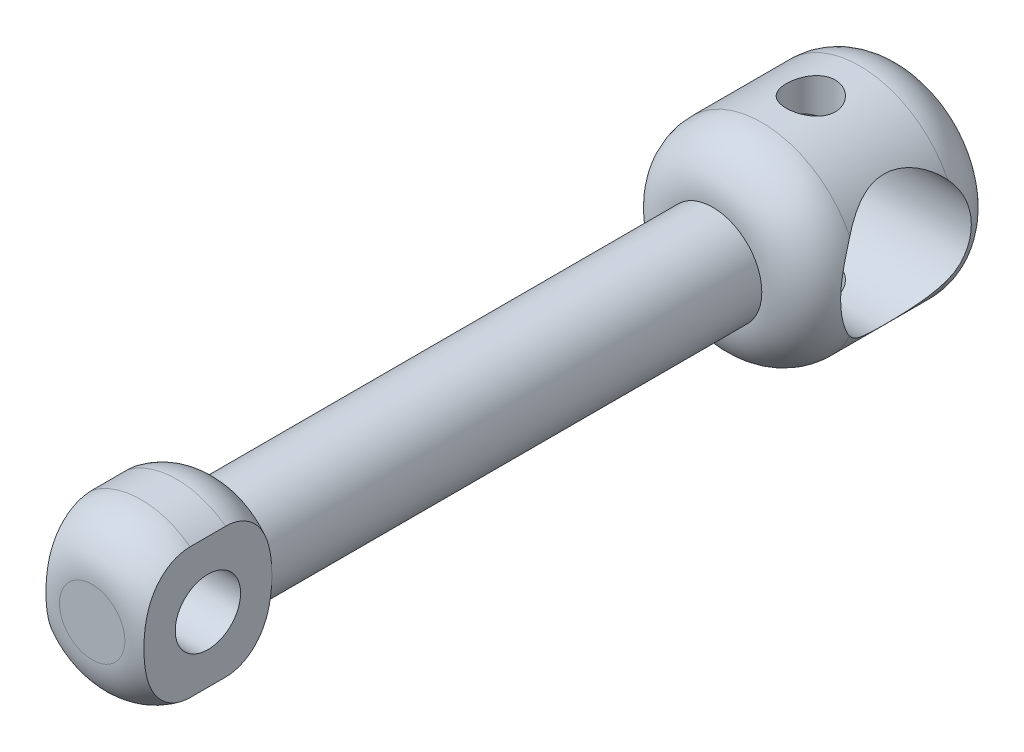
SolidWorks part; units mm, degrees
ref_plane "Front Plane" through (0, 0, 0) normal (0, 0, 1) x (1, 0, 0)
ref_plane "Top Plane" through (0, 0, 0) normal (0, 1, 0) x (1, 0, 0)
ref_plane "Right Plane" through (0, 0, 0) normal (1, 0, 0) x (0, 0, -1)
sketch "Sketch1" plane through (0, 0, 0) normal (0, 0, 1) x (1, 0, 0)
  circle A0 centre (0, 0) radius 6
  dimension "D1" = 12
extrude "Extrude1" add sketch "Sketch1" along normal blind 12
sketch "Sketch2" plane through (0, 0, 12) normal (0, 0, 1) x (1, 0, 0)
  circle A0 centre (0, 0) radius 3
  dimension "D1" = 6
extrude "Extrude2" add sketch "Sketch2" along normal blind 30
sketch "Sketch3" plane through (0, 0, 42) normal (0, 0, 1) x (1, 0, 0)
  circle A0 centre (0, 0) radius 5
  dimension "D1" = 10
extrude "Extrude3" add sketch "Sketch3" along normal blind 8
sketch "Sketch4" plane through (0, 0, 50) normal (0, 0, 1) x (1, 0, 0)
  line L1 (-3, 7.1133) -> (3, 7.1133)
  line L2 (-3, 7.1133) -> (-3, -7.1133)
  line L3 (-3, -7.1133) -> (3, -7.1133)
  line L4 (3, 7.1133) -> (3, -7.1133)
  line L5 (-3, 7.1133) -> (3, -7.1133) construction
  line L6 (-3, -7.1133) -> (3, 7.1133) construction
  point P0 (0, 0)
  dimension "D1" = 6
extrude "Extrude4" cut sketch "Sketch4" against normal up to surface (8 mm away) flip side to cut
fillet "Fillet1" radius 3 6 edges at (0, 5, 50) (0, -5, 50) (0, -5, 42) (0, 5, 42) (6, 0, 0) (6, 0, 12)
sketch "Sketch5" plane through (0, 0, 0) normal (1, 0, 0) x (0, 0, -1)
  line L0 (-45.9142, 4) -> (-45.9142, 0) construction
  line L1 (-44.8284, 4) -> (-47, 4) construction
  line L2 (-6, 6) -> (-6, 0) construction
  line L3 (-3, 6) -> (-9, 6) construction
  circle A0 centre (-45.9142, 0) radius 2
  circle A1 centre (-6, 0) radius 4
  dimension "D1" = 4
  dimension "D2" = 8
extrude "Extrude5" cut sketch "Sketch5" against normal through all and the other way through all
sketch "Sketch6" plane through (0, 0, 0) normal (0, 1, 0) x (1, 0, 0)
  line L0 (3, 0) -> (-3, 0) construction
  circle A0 centre (0, -6) radius 1.5
  dimension "D1" = 6
  dimension "D2" = 3
extrude "Extrude6" cut sketch "Sketch6" against normal through all and the other way through all
equation "\"D1@Sketch6\" = \"D1@Extrude1\"/2"
